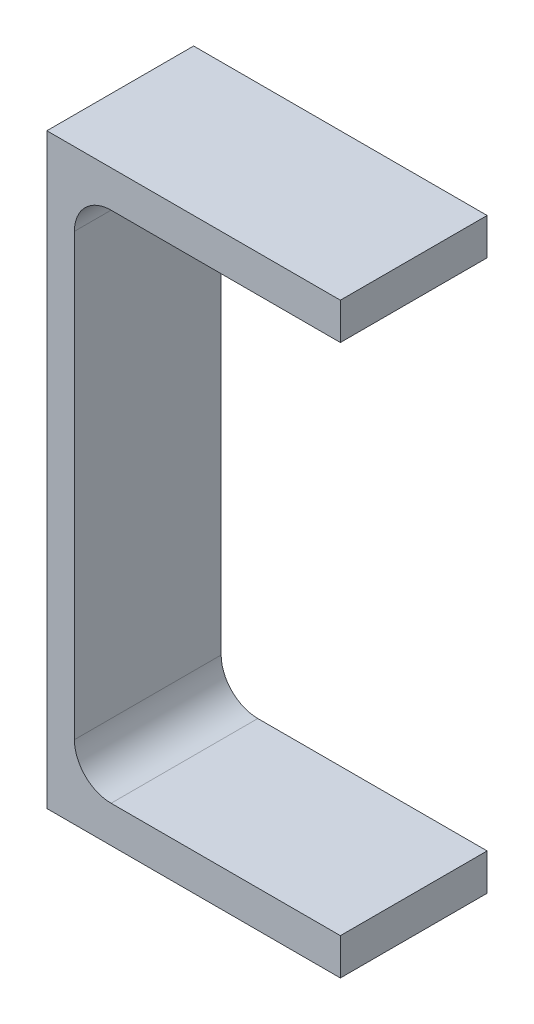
SolidWorks part; units mm, degrees
ref_plane "Plane1" through (0, 0, 0) normal (0, 0, 1) x (1, 0, 0)
ref_plane "Plane2" through (0, 0, 0) normal (0, 1, 0) x (1, 0, 0)
ref_plane "Plane3" through (0, 0, 0) normal (1, 0, 0) x (0, 0, -1)
sketch "Sketch1" plane through (0, 0, 0) normal (0, 0, 1) x (1, 0, 0)
  line L0 (0, 0) -> (0, 101.6)
  line L2 (4.7625, 88.9) -> (4.7625, 12.7)
  line L3 (11.1125, 6.35) -> (50.8, 6.35)
  line L4 (50.8, 12.7) -> (50.8, 0) construction
  line L5 (50.8, 0) -> (0, 0)
  line L6 (50.8, 101.6) -> (0, 101.6)
  line L7 (50.8, 0) -> (50.8, 6.35)
  line L8 (50.8, 101.6) -> (50.8, 95.25)
  line L9 (11.1125, 95.25) -> (50.8, 95.25)
  arc A0 (4.7625, 88.9) -> (11.1125, 95.25) centre (11.1125, 88.9) cw
  arc A2 (11.1125, 6.35) -> (4.7625, 12.7) centre (11.1125, 12.7) cw
  dimension "D1" = 6.35
  dimension "Thickness" = 6.35
  dimension "tw" = 4.7625
  dimension "V_Leg" = 101.6
extrude "BaseChannelse" add sketch "Sketch1" along normal mid plane 25.4
equation "\"D1@Sketch1\" = \"Thickness@Sketch1\""
